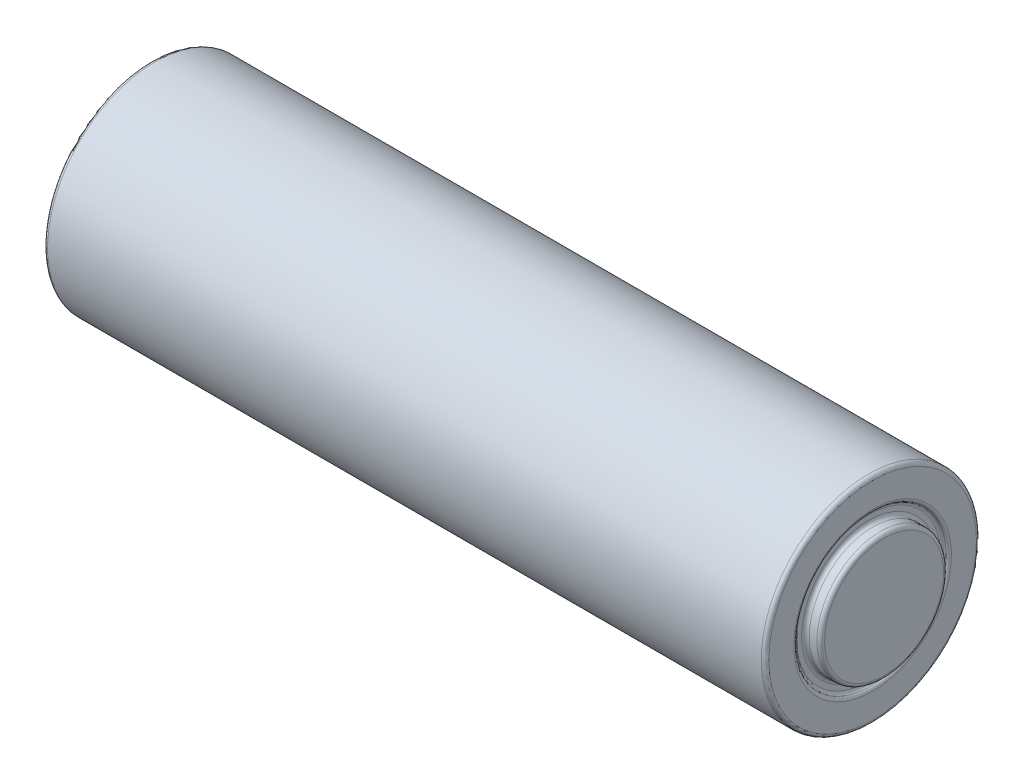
SolidWorks part; units mm, degrees
ref_plane "Plane1" through (0, 0, 0) normal (0, 0, 1) x (1, 0, 0)
ref_plane "Plane2" through (0, 0, 0) normal (0, 1, 0) x (1, 0, 0)
ref_plane "Plane3" through (0, 0, 0) normal (1, 0, 0) x (0, 0, -1)
sketch "Sketch1" plane through (0, 0, 0) normal (0, 0, 1) x (1, 0, 0)
  line L0 (0, 7.112) -> (47.6758, 7.112)
  line L1 (0, 7.112) -> (0, 0)
  line L2 (47.6758, 0) -> (0, 0)
  line L3 (47.6758, 0) -> (47.6758, 7.112)
  line L4 (0, 0) -> (47.6758, 0) construction
  dimension "BodyLength" = 47.6758
  dimension "BodyRadius" = 7.112
revolve "Base-Revolve" add sketch "Sketch1" angle 360 about L4
sketch "Sketch2" plane through (0, 0, 0) normal (-1, 0, 0) x (0, 0, 1)
  circle A0 centre (0, 0) radius 5.2578
  dimension "PositiveDepressionDiameter" = 10.5156
extrude "Cut-Extrude1" cut sketch "Sketch2" against normal blind 0.254
sketch "Sketch3" plane through (0.254, 0, 0) normal (-1, 0, 0) x (0, 0, 1)
  circle A0 centre (0, 0) radius 2.667
  dimension "PositiveExtentionDiameter" = 5.334
extrude "Boss-Extrude1" add sketch "Sketch3" along normal blind 1.524
sketch "Sketch4" plane through (47.6758, 0, 0) normal (1, 0, 0) x (0, 0, -1)
  circle A0 centre (0, 0) radius 4.953
  dimension "NegativeDepressionDiameter" = 9.906
extrude "Cut-Extrude2" cut sketch "Sketch4" against normal blind 0.254
sketch "Sketch5" plane through (47.4218, 0, 0) normal (1, 0, 0) x (0, 0, -1)
  circle A0 centre (0, 0) radius 4.191
  dimension "NegativeExtentionDiameter" = 8.382
extrude "Boss-Extrude2" add sketch "Sketch5" along normal blind 1.016
fillet "Fillet2" radius 0.254 4 edges at (0.254, -2.667, 0) (-1.27, -2.667, 0) (0, -7.112, 0) (0, -5.2578, 0)
fillet "Fillet3" radius 0.254 1 edges at (0.254, -5.2578, 0)
fillet "Fillet4" radius 0.254 4 edges at (47.6758, 4.953, 0) (47.4218, 4.191, 0) (48.4378, 4.191, 0) (47.6758, -7.112, 0)
fillet "Fillet5" radius 0.254 1 edges at (47.4218, 4.953, 0)
